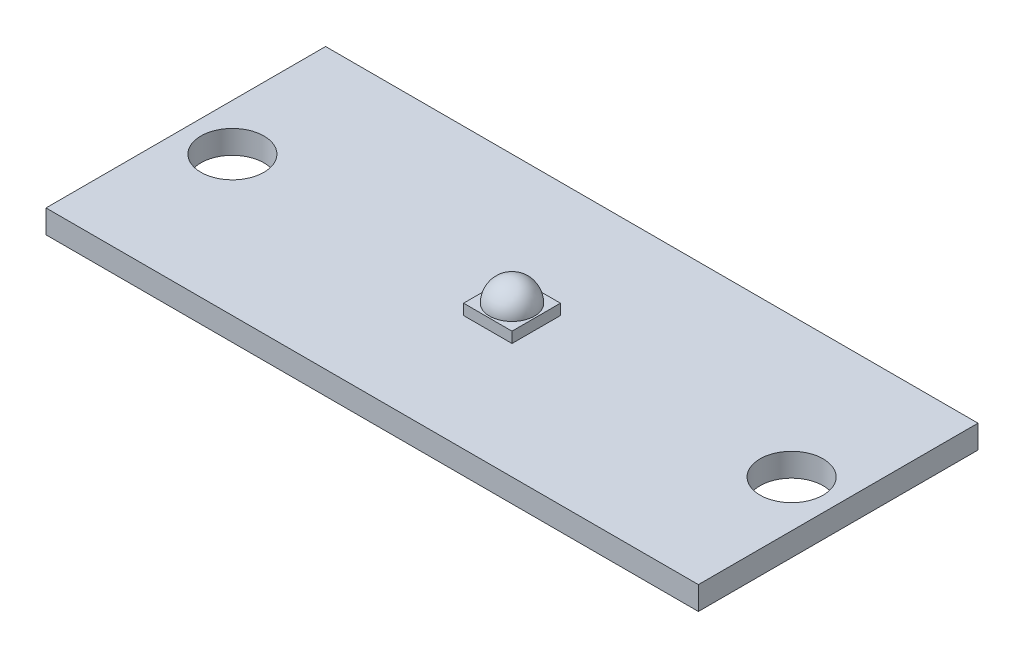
SolidWorks part; units mm, degrees
ref_plane "Front Plane" through (0, 0, 0) normal (0, 0, 1) x (1, 0, 0)
ref_plane "Top Plane" through (0, 0, 0) normal (0, 1, 0) x (1, 0, 0)
ref_plane "Right Plane" through (0, 0, 0) normal (1, 0, 0) x (0, 0, -1)
sketch "Sketch1" plane through (0, 0, 0) normal (0, 1, 0) x (1, 0, 0)
  line L0 (-19.05, 0) -> (19.05, 0) construction
  line L1 (-22.225, -9.525) -> (22.225, -9.525)
  line L2 (-22.225, -9.525) -> (-22.225, 9.525)
  line L3 (-22.225, 9.525) -> (22.225, 9.525)
  line L4 (22.225, -9.525) -> (22.225, 9.525)
  line L5 (-22.225, -9.525) -> (22.225, 9.525) construction
  line L6 (-22.225, 9.525) -> (22.225, -9.525) construction
  circle A0 centre (-19.05, 0) radius 2.1463
  circle A1 centre (19.05, 0) radius 2.1463
  point P0 (0, 0)
  dimension "D2" = 4.2926
  dimension "D1" = 38.1
  dimension "D3" = 44.45
  dimension "D4" = 19.05
extrude "PCB" add sketch "Sketch1" along normal blind 1.5875
sketch "Sketch2" plane through (0, 1.5875, 0) normal (0, 1, 0) x (1, 0, 0)
  line L1 (1.65, -1.65) -> (-1.65, -1.65)
  line L2 (1.65, -1.65) -> (1.65, 1.65)
  line L3 (1.65, 1.65) -> (-1.65, 1.65)
  line L4 (-1.65, -1.65) -> (-1.65, 1.65)
  line L5 (1.65, -1.65) -> (-1.65, 1.65) construction
  line L6 (1.65, 1.65) -> (-1.65, -1.65) construction
  point P0 (0, 0)
  dimension "D1" = 3.3
extrude "LED" add sketch "Sketch2" along normal blind 0.73
sketch "Sketch3" plane through (0, 0, 0) normal (1, 0, 0) x (0, 0, -1)
  line L0 (0, -1.7491) -> (0, 7.2332) construction
  line L1 (0, 3.8475) -> (0, 2.3175)
  line L2 (0, 2.3175) -> (1.53, 2.3175)
  line L3 (-1.65, 1.5875) -> (1.65, 1.5875) construction
  line L4 (-1.65, 2.3175) -> (1.65, 2.3175) construction
  arc A0 (1.53, 2.3175) -> (0, 3.8475) centre (0, 2.3175) ccw
  dimension "D1" = 1.53
  dimension "D2" = 2.26
revolve "Revolve1" add sketch "Sketch3" angle 360 about L0
